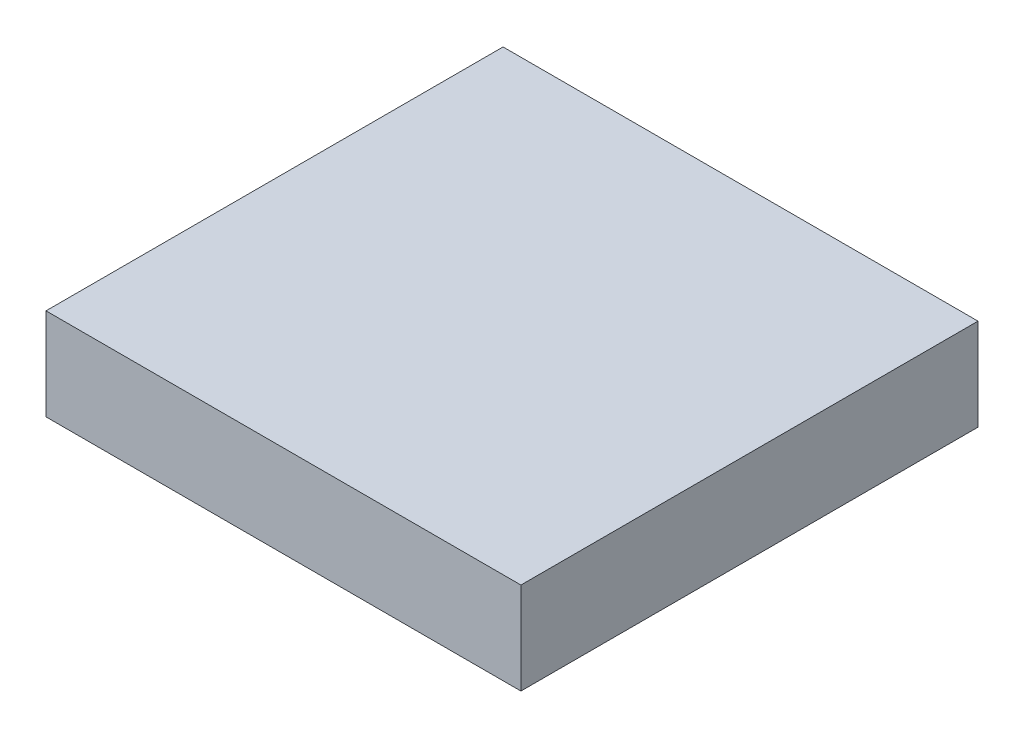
SolidWorks part; units mm, degrees
ref_plane "Front Plane" through (0, 0, 0) normal (0, 0, 1) x (1, 0, 0)
ref_plane "Top Plane" through (0, 0, 0) normal (0, 1, 0) x (1, 0, 0)
ref_plane "Right Plane" through (0, 0, 0) normal (1, 0, 0) x (0, 0, -1)
sketch "Sketch1" plane through (0, 0, 0) normal (0, 0, 1) x (1, 0, 0)
  line L1 (0, 0) -> (203.9945, 0)
  line L2 (0, 0) -> (0, 39.4484)
  line L3 (0, 39.4484) -> (203.9945, 39.4484)
  line L4 (203.9945, 0) -> (203.9945, 39.4484)
extrude "Boss-Extrude1" add sketch "Sketch1" along normal blind 196.3309
